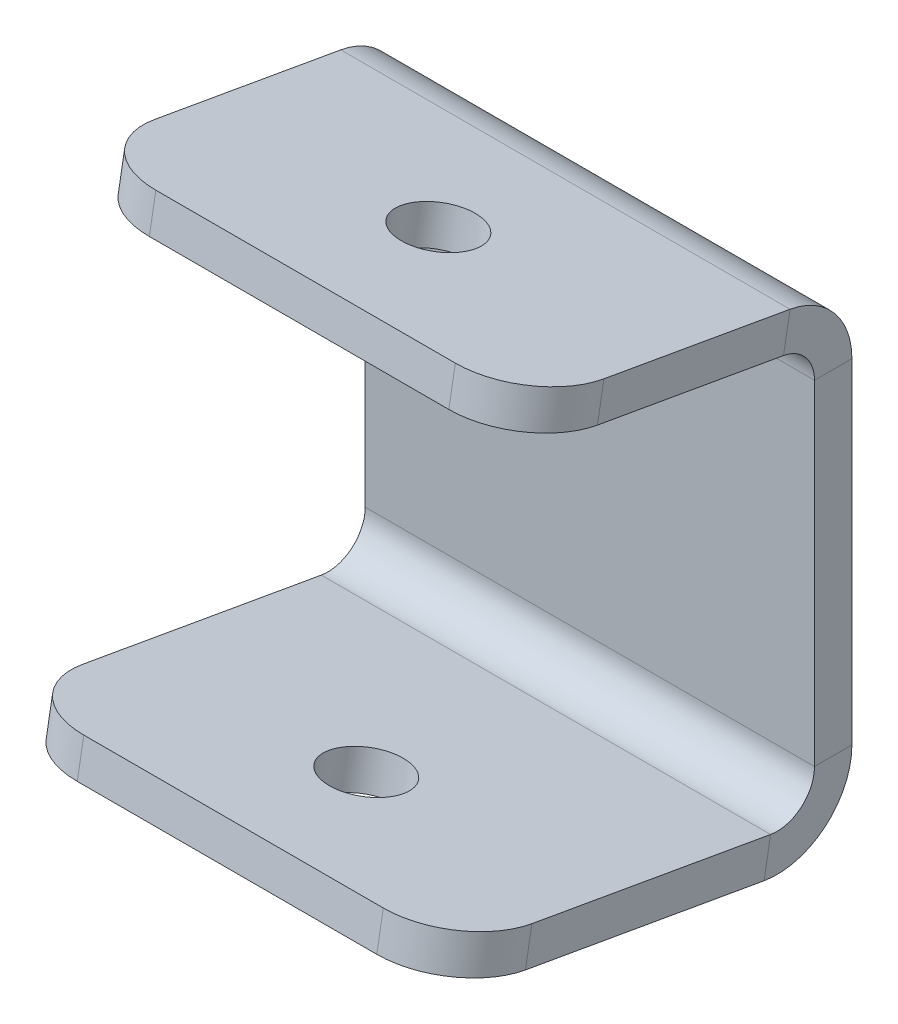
SolidWorks part; units mm, degrees
ref_plane "Plan1" through (0, 0, 0) normal (0, 0, 1) x (1, 0, 0)
ref_plane "Plan2" through (0, 0, 0) normal (0, 1, 0) x (1, 0, 0)
ref_plane "Plan3" through (0, 0, 0) normal (1, 0, 0) x (0, 0, -1)
sketch "Esquisse1" plane through (0, 0, 0) normal (0, 0, 1) x (1, 0, 0)
  line L0 (-20, 120) -> (20, 120)
  line L2 (20, -18) -> (-20, -18)
  line L3 (30, -8) -> (30, 110)
  line L6 (-30, 110) -> (-30, -8)
  circle A0 centre (0, 102) radius 5
  arc A1 (30, 110) -> (20, 120) centre (20, 110) ccw
  arc A2 (-20, -18) -> (-30, -8) centre (-20, -8) cw
  arc A3 (30, -8) -> (20, -18) centre (20, -8) cw
  circle A4 centre (0, 0) radius 5
  arc A7 (-30, 110) -> (-20, 120) centre (-20, 110) cw
  point P10 (30, 120)
  point P15 (30, -18)
  dimension "D4" = 60
  dimension "D5" = 18
  dimension "D6" = 18
  dimension "D2" = 10
  dimension "D13" = 10
  dimension "D3" = 138
  dimension "D18" = 30
extrude "Base-Extrusion" add sketch "Esquisse1" along normal blind 5
sheet metal parameters "Tôlerie 1" parameters "D1"=5
flatten bends "Dépliage 1" parameters "D1"=5
sketch "Esquisse-Angle1" plane through (0, 0, 5) normal (0, 0, 1) x (1, 0, 0)
process bends "Pliage 1"
sketch "Esquisse-Plate1" plane through (0, 0, 5) normal (0, 0, 1) x (1, 0, 0)
  line L0 (-30, 81.269) -> (30, 81.269) construction
  line L3 (-30, 28.731) -> (30, 28.731) construction
  line L4 (-30, 110) -> (-30, -8) construction
  line L5 (30, -8) -> (30, 110) construction
  line L10 (20, 120) -> (-29.1, 120) construction
  line L11 (20, -18) -> (-20, -18) construction
  point P0 (0, 40.731)
  dimension "D1" = 46.731
  dimension "D2" = 52.538
  dimension "D5" = 38.731
bend "Pli défini à plat3" bend radius 5 bend angle 100 parameters "D5"=1
bend "Pli défini à plat7" bend radius 5 bend angle 80 parameters "D5"=2
sketch "Esquisse2" plane through (0, 0, 0) normal (0, 0, -1) x (-1, 0, 0)
  line L1 (-30, 33.0987) -> (30, 77.7749) construction
  point P0 (0, 55.4368)
